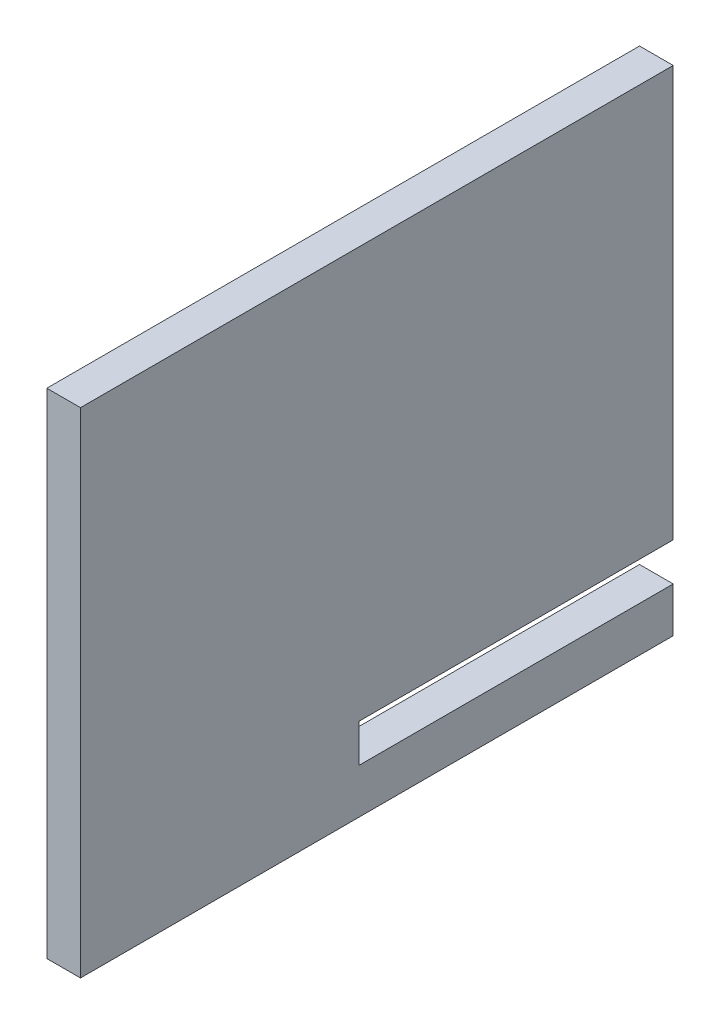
SolidWorks part; units mm, degrees
ref_plane "Alzado" through (0, 0, 0) normal (0, 0, 1) x (1, 0, 0)
ref_plane "Planta" through (0, 0, 0) normal (0, 1, 0) x (1, 0, 0)
ref_plane "Vista lateral" through (0, 0, 0) normal (1, 0, 0) x (0, 0, -1)
sketch "Croquis16" plane through (0, 0, 0) normal (0, 0, 1) x (1, 0, 0)
  line L0 (-18.25, -39.75) -> (-16.75, -39.75)
  line L1 (-18.5, -40) -> (-16.5, -40) construction
  line L2 (-18.5, -40) -> (-18.5, 40) construction
  line L3 (-18.5, 40) -> (-16.5, 40) construction
  line L4 (-16.5, -40) -> (-16.5, 40) construction
  line L5 (-16.75, -39.75) -> (-16.75, 39.75)
  line L6 (-18.25, 39.75) -> (-16.75, 39.75)
  line L7 (-18.25, -39.75) -> (-18.25, 39.75)
  dimension "D1" = 0.25
extrude "Saliente-Extruir9" add sketch "Croquis16" along normal blind 26.4
sketch "Croquis20" plane through (-16.75, 0, 0) normal (1, 0, 0) x (0, 0, -1)
  line L1 (0, -20.85) -> (-14, -20.85)
  line L2 (0, -20.85) -> (0, -19.15)
  line L3 (0, -19.15) -> (-14, -19.15)
  line L4 (-14, -20.85) -> (-14, -19.15)
  line L10 (0, -0.85) -> (-14, -0.85)
  line L11 (0, -0.85) -> (0, 0.85)
  line L12 (0, 0.85) -> (-14, 0.85)
  line L13 (-14, -0.85) -> (-14, 0.85)
  line L14 (0, 19.15) -> (-14, 19.15)
  line L15 (0, 19.15) -> (0, 20.85)
  line L16 (0, 20.85) -> (-14, 20.85)
  line L17 (-14, 19.15) -> (-14, 20.85)
  line L22 (0, -39.75) -> (0, 39.75) construction
  dimension "D1" = 1.7
  dimension "D2" = 14
  dimension "D4" = 1.7
  dimension "D5" = 1.7
  dimension "D6" = 14
  dimension "D7" = 14
extrude "Cortar-Extruir2" cut sketch "Croquis20" against normal up to surface (1.5 mm away)
sketch "Croquis21" plane through (-16.75, 0, 0) normal (1, 0, 0) x (0, 0, -1)
  line L1 (0, -22.85) -> (-26.4, -22.85)
  line L2 (0, -22.85) -> (0, -39.75)
  line L3 (0, -39.75) -> (-26.4, -39.75)
  line L4 (-26.4, -22.85) -> (-26.4, -39.75)
  line L5 (-14, -20.85) -> (0, -20.85) construction
  line L7 (0, 39.75) -> (-26.4, 39.75)
  line L8 (0, 39.75) -> (0, -0.85)
  line L9 (0, -0.85) -> (-26.4, -0.85)
  line L10 (-26.4, 39.75) -> (-26.4, -0.85)
  dimension "D1" = 2
extrude "Cortar-Extruir3" cut sketch "Croquis21" against normal up to surface (1.5 mm away)
